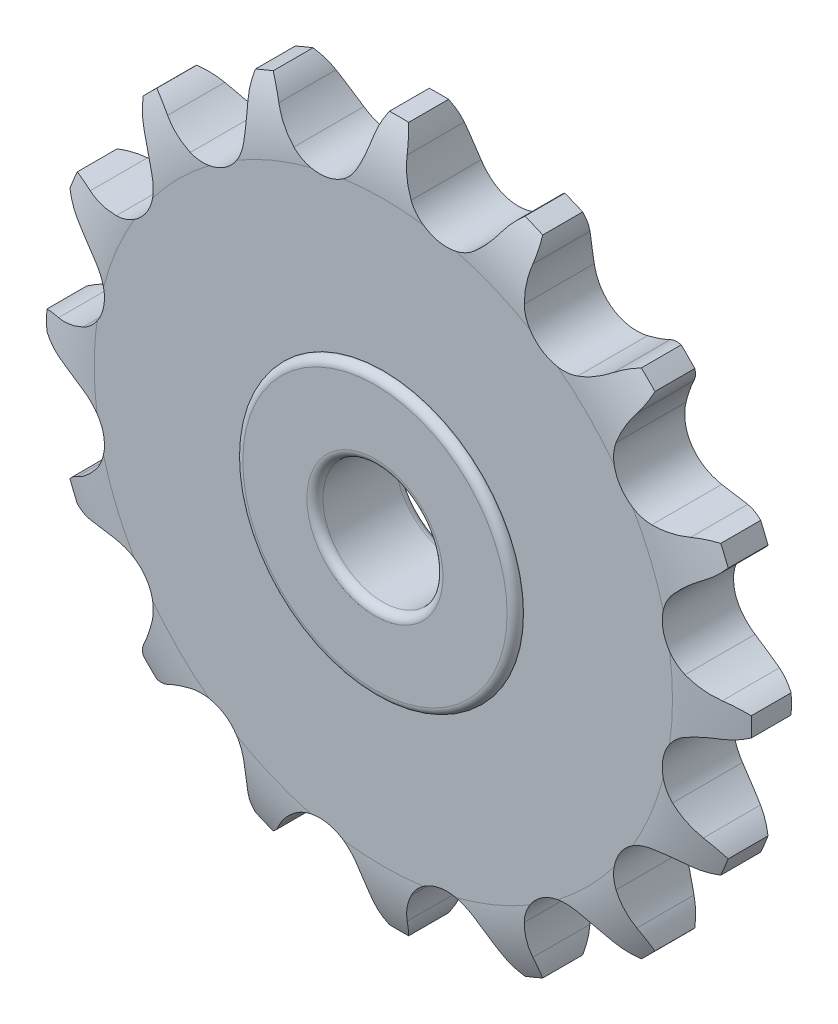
SolidWorks part; units mm, degrees
other "Imported1"
ref_plane "Front" through (0, 0, 0) normal (0, 0, 1) x (1, 0, 0)
ref_plane "Top" through (0, 0, 0) normal (0, 1, 0) x (1, 0, 0)
ref_plane "Right" through (0, 0, 0) normal (1, 0, 0) x (0, 0, -1)
imported_body "ｲﾝﾎﾟｰﾄ1"
sketch "ｽｹｯﾁ1" plane through (0, 0, 0) normal (0, 0, 1) x (1, 0, 0)
  circle A0 centre (0, 0) radius 57.5377
  circle A1 centre (0, 0) radius 44
  dimension "D1" = 88
extrude "ｶｯﾄ - 押し出し1" cut sketch "ｽｹｯﾁ1" against normal through all both and the other way through all
